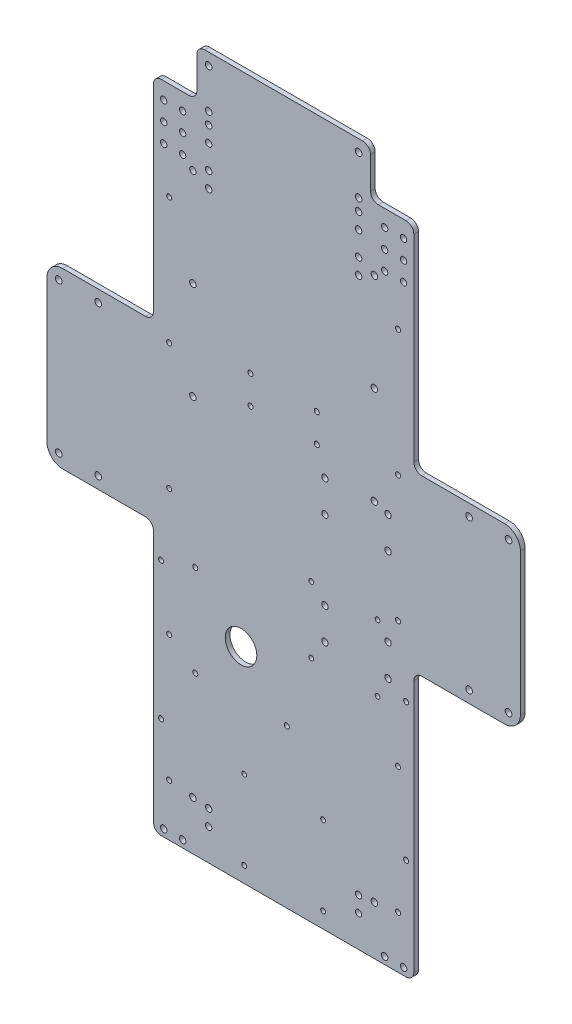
SolidWorks part; units mm, degrees
ref_plane "前视基准面" through (0, 0, 0) normal (0, 0, 1) x (1, 0, 0)
ref_plane "上视基准面" through (0, 0, 0) normal (0, 1, 0) x (1, 0, 0)
ref_plane "右视基准面" through (0, 0, 0) normal (1, 0, 0) x (0, 0, -1)
sketch "草图1" plane through (0, 0, 0) normal (0, 0, 1) x (1, 0, 0)
  line L0 (-50.9061, 33.4951) -> (-35.9061, 33.4951)
  line L1 (-50.9061, 103.4951) -> (79.0939, 103.4951)
  line L2 (-50.9061, 103.4951) -> (-50.9061, 33.4951)
  line L3 (-35.9061, -91.5049) -> (64.0939, -91.5049)
  line L4 (79.0939, 103.4951) -> (79.0939, 33.4951)
  line L5 (-35.9061, 33.4951) -> (-35.9061, -91.5049)
  line L6 (64.0939, -91.5049) -> (64.0939, 33.4951)
  line L7 (64.0939, 33.4951) -> (79.0939, 33.4951)
  dimension "D1" = 130
  dimension "D2" = 100
  dimension "D3" = 15
  dimension "D4" = 70
  dimension "D5" = 70
  dimension "D6" = 195
extrude "凸台-拉伸1" add sketch "草图1" along normal blind 3
sketch "草图2" plane through (0, 0, 3) normal (0, 0, 1) x (1, 0, 0)
  line L0 (79.0939, 103.4951) -> (-50.9061, 103.4951) construction
  line L1 (-40.9061, 103.4951) -> (69.0939, 103.4951)
  line L2 (-40.9061, 103.4951) -> (-40.9061, 123.4951)
  line L3 (-40.9061, 123.4951) -> (69.0939, 123.4951)
  line L4 (69.0939, 103.4951) -> (69.0939, 123.4951)
  line L5 (14.0939, -91.5049) -> (14.0939, 116.1376) construction
  line L6 (-35.9061, -91.5049) -> (64.0939, -91.5049) construction
  dimension "D1" = 55
  dimension "D2" = 55
  dimension "D3" = 20
extrude "凸台-拉伸2" add sketch "草图2" against normal up to surface (3 mm away)
sketch "草图3" plane through (0, 0, 3) normal (0, 0, 1) x (1, 0, 0)
  line L1 (-35.9061, 33.4951) -> (-95.9061, 33.4951)
  line L2 (-35.9061, 33.4951) -> (-35.9061, -116.5049)
  line L3 (-35.9061, -116.5049) -> (-95.9061, -116.5049)
  line L4 (-95.9061, 33.4951) -> (-95.9061, -116.5049)
  line L5 (64.0939, 33.4951) -> (124.0939, 33.4951)
  line L6 (64.0939, 33.4951) -> (64.0939, -116.5049)
  line L7 (64.0939, -116.5049) -> (124.0939, -116.5049)
  line L8 (124.0939, 33.4951) -> (124.0939, -116.5049)
  dimension "D1" = 60
  dimension "D2" = 150
  dimension "D3" = 150
  dimension "D4" = 60
extrude "凸台-拉伸3" add sketch "草图3" against normal up to surface (3 mm away)
sketch "草图4" plane through (0, 0, 3) normal (0, 0, 1) x (1, 0, 0)
  line L0 (-35.9061, -91.5049) -> (64.0939, -91.5049) construction
  line L1 (-35.9061, -91.5049) -> (64.0939, -91.5049)
  line L2 (-35.9061, -91.5049) -> (-35.9061, -261.5049)
  line L3 (-35.9061, -261.5049) -> (64.0939, -261.5049)
  line L4 (64.0939, -91.5049) -> (64.0939, -261.5049)
  dimension "D1" = 170
extrude "凸台-拉伸4" add sketch "草图4" against normal up to surface (3 mm away)
sketch "草图5" plane through (0, 0, 0) normal (0, 0, -1) x (-1, 0, 0)
  line L0 (-79.0939, 103.4951) -> (-69.0939, 103.4951) construction
  line L1 (-69.0939, 123.4951) -> (-69.0939, 103.4951) construction
  line L2 (-14.0939, 123.4951) -> (-14.0939, 75.6641) construction
  line L3 (40.9061, 123.4951) -> (-69.0939, 123.4951) construction
  circle A0 centre (-61.5939, 118.4951) radius 2.05
  circle A1 centre (-61.5939, 108.4951) radius 2.05
  circle A2 centre (33.4061, 108.4951) radius 2.05
  circle A3 centre (33.4061, 118.4951) radius 2.05
  dimension "D1" = 4.1
  dimension "D2" = 4.1
  dimension "D3" = 10
  dimension "D4" = 5
  dimension "D5" = 7.5
  dimension "D6" = 7.5
extrude "切除-拉伸1" cut sketch "草图5" against normal blind 10
sketch "草图6" plane through (0, 0, 0) normal (0, 0, -1) x (-1, 0, 0)
  line L0 (-14.0939, 123.4951) -> (-14.0939, -261.5049) construction
  line L1 (40.9061, 123.4951) -> (-69.0939, 123.4951) construction
  line L2 (-64.0939, -261.5049) -> (35.9061, -261.5049) construction
  line L4 (-39.0939, -201.5049) -> (10.9061, -201.5049) construction
  line L5 (-39.0939, -201.5049) -> (-39.0939, -251.5049) construction
  line L6 (-39.0939, -251.5049) -> (10.9061, -251.5049) construction
  line L7 (10.9061, -201.5049) -> (10.9061, -251.5049) construction
  circle A0 centre (10.9061, -201.5049) radius 1.5
  circle A1 centre (-39.0939, -201.5049) radius 1.5
  circle A2 centre (-39.0939, -251.5049) radius 1.5
  circle A3 centre (10.9061, -251.5049) radius 1.5
  dimension "D5" = 3
  dimension "D6" = 3
  dimension "D7" = 3
  dimension "D8" = 3
  dimension "D1" = 50
  dimension "D2" = 50
  dimension "D3" = 25
  dimension "D4" = 10
extrude "切除-拉伸2" cut sketch "草图6" against normal blind 10
sketch "草图7" plane through (0, 0, 0) normal (0, 0, -1) x (-1, 0, 0)
  line L0 (-64.0939, -116.5049) -> (-64.0939, -261.5049) construction
  line L1 (-124.0939, -116.5049) -> (-64.0939, -116.5049)
  line L2 (-124.0939, -116.5049) -> (-124.0939, -171.5049)
  line L3 (-124.0939, -171.5049) -> (-64.0939, -171.5049)
  line L4 (-64.0939, -116.5049) -> (-64.0939, -171.5049)
  line L5 (-14.0939, 123.4951) -> (-14.0939, -261.5049) construction
  line L6 (40.9061, 123.4951) -> (-69.0939, 123.4951) construction
  line L7 (-64.0939, -261.5049) -> (35.9061, -261.5049) construction
  line L8 (35.9061, -116.5049) -> (35.9061, -171.5049)
  line L9 (95.9061, -171.5049) -> (35.9061, -171.5049)
  line L10 (95.9061, -116.5049) -> (95.9061, -171.5049)
  line L11 (95.9061, -116.5049) -> (35.9061, -116.5049)
  dimension "D1" = 55
extrude "凸台-拉伸5" add sketch "草图7" against normal up to surface (3 mm away)
sketch "草图8" plane through (0, 0, 0) normal (0, 0, -1) x (-1, 0, 0)
  line L0 (-114.0939, -36.5049) -> (85.9061, -36.5049) construction
  line L1 (-124.0939, 33.4951) -> (-124.0939, -171.5049) construction
  line L3 (-14.0939, 123.4951) -> (-14.0939, -261.5049) construction
  line L4 (40.9061, 123.4951) -> (-69.0939, 123.4951) construction
  line L5 (-64.0939, -261.5049) -> (35.9061, -261.5049) construction
  circle A0 centre (-114.0939, 10.9951) radius 2
  circle A1 centre (-104.0939, 10.9951) radius 2
  circle A4 centre (-104.0939, -84.0049) radius 2
  circle A5 centre (-114.0939, -84.0049) radius 2
  circle A6 centre (85.9061, -84.0049) radius 2
  circle A7 centre (75.9061, -84.0049) radius 2
  circle A8 centre (75.9061, 10.9951) radius 2
  circle A9 centre (85.9061, 10.9951) radius 2
  dimension "D1" = 4
  dimension "D2" = 4
  dimension "D3" = 10
  dimension "D4" = 10
  dimension "D5" = 47.5
  dimension "D6" = 47.5
  dimension "D7" = 160
extrude "切除-拉伸3" cut sketch "草图8" against normal blind 10
sketch "草图9" plane through (0, 0, 0) normal (0, 0, -1) x (-1, 0, 0)
  line L0 (-14.0939, -261.5049) -> (-14.0939, -180.2572) construction
  line L1 (-64.0939, -261.5049) -> (35.9061, -261.5049) construction
  circle A0 centre (33.4061, -231.5049) radius 2
  circle A1 centre (33.4061, -241.5049) radius 2
  circle A2 centre (-61.5939, -241.5049) radius 2
  circle A3 centre (-61.5939, -231.5049) radius 2
  dimension "D1" = 4
  dimension "D2" = 4
  dimension "D3" = 10
  dimension "D4" = 20
  dimension "D5" = 47.5
  dimension "D6" = 47.5
extrude "切除-拉伸4" cut sketch "草图9" against normal blind 10
sketch "草图10" plane through (0, 0, 0) normal (0, 0, -1) x (-1, 0, 0)
  line L0 (-124.0939, -171.5049) -> (-64.0939, -171.5049) construction
  line L1 (-64.0939, -261.5049) -> (-69.0939, -261.5049)
  line L2 (-64.0939, -261.5049) -> (-64.0939, -171.5049)
  line L3 (-64.0939, -171.5049) -> (-69.0939, -171.5049)
  line L4 (-69.0939, -261.5049) -> (-69.0939, -171.5049)
  line L5 (-14.0939, -261.5049) -> (-14.0939, -148.6637) construction
  line L6 (-64.0939, -261.5049) -> (35.9061, -261.5049) construction
  line L7 (40.9061, -261.5049) -> (40.9061, -171.5049)
  line L8 (35.9061, -171.5049) -> (40.9061, -171.5049)
  line L9 (35.9061, -261.5049) -> (35.9061, -171.5049)
  line L10 (35.9061, -261.5049) -> (40.9061, -261.5049)
  circle A0 centre (-61.5939, -231.5049) radius 2 construction
  dimension "D1" = 7.5
extrude "凸台-拉伸6" add sketch "草图10" against normal up to surface (3 mm away)
sketch "草图11" plane through (0, 0, 0) normal (0, 0, -1) x (-1, 0, 0)
  line L1 (-69.0939, -261.5049) -> (40.9061, -261.5049)
  line L2 (-69.0939, -261.5049) -> (-69.0939, -266.5049)
  line L3 (-69.0939, -266.5049) -> (40.9061, -266.5049)
  line L4 (40.9061, -261.5049) -> (40.9061, -266.5049)
  dimension "D1" = 5
extrude "凸台-拉伸7" add sketch "草图11" against normal up to surface (3 mm away)
sketch "草图12" plane through (0, 0, 0) normal (0, 0, -1) x (-1, 0, 0)
  line L0 (-79.0939, 68.4951) -> (50.9061, 68.4951) construction
  line L1 (-79.0939, 33.4951) -> (-79.0939, 103.4951) construction
  line L2 (50.9061, 103.4951) -> (50.9061, 33.4951) construction
  line L3 (-14.0939, 123.4951) -> (-14.0939, -31.782) construction
  line L4 (40.9061, 123.4951) -> (-69.0939, 123.4951) construction
  line L5 (-14.0939, 68.4951) -> (-60.2666, -58.3634) construction
  line L6 (-14.0939, 68.4951) -> (10.2169, -69.3779) construction
  line L7 (-40.2666, -103.3634) -> (-80.2666, -103.3634) construction
  line L8 (-40.2666, -103.3634) -> (-40.2666, -13.3634) construction
  line L9 (-40.2666, -13.3634) -> (-80.2666, -13.3634) construction
  line L10 (-80.2666, -103.3634) -> (-80.2666, -13.3634) construction
  line L11 (-40.2666, -103.3634) -> (-80.2666, -13.3634) construction
  line L12 (-40.2666, -13.3634) -> (-80.2666, -103.3634) construction
  circle A0 centre (-14.0939, 68.4951) radius 97.5 construction
  circle A1 centre (-40.2666, -13.3634) radius 2
  circle A2 centre (-40.2666, -103.3634) radius 2
  circle A3 centre (-80.2666, -103.3634) radius 2
  circle A4 centre (-80.2666, -13.3634) radius 2
  circle A5 centre (-14.0939, 68.4951) radius 140 construction
  dimension "D1" = 195
  dimension "D3" = 90
  dimension "D4" = 135
  dimension "D5" = 40
  dimension "D6" = 4
  dimension "D7" = 4
  dimension "D8" = 4
  dimension "D9" = 4
  dimension "D2" = 20
  dimension "D10" = 140
  dimension "D12" = 10
extrude "切除-拉伸6" cut sketch "草图12" against normal blind 10
sketch "草图14" plane through (0, 0, 0) normal (0, 0, -1) x (-1, 0, 0)
  line L0 (-14.0939, 123.4951) -> (-14.0939, -266.5049) construction
  line L1 (-124.0939, 33.4951) -> (-100.0939, 33.4951)
  line L2 (-124.0939, 33.4951) -> (-124.0939, 18.4951)
  line L3 (-124.0939, 18.4951) -> (-100.0939, 18.4951)
  line L4 (-100.0939, 33.4951) -> (-100.0939, 18.4951)
  line L5 (-124.0939, -171.5049) -> (-100.0939, -171.5049)
  line L6 (-124.0939, -171.5049) -> (-124.0939, -91.5049)
  line L7 (-124.0939, -91.5049) -> (-100.0939, -91.5049)
  line L8 (-100.0939, -171.5049) -> (-100.0939, -91.5049)
  line L9 (40.9061, 123.4951) -> (-69.0939, 123.4951) construction
  line L10 (-69.0939, -266.5049) -> (40.9061, -266.5049) construction
  line L11 (71.9061, -171.5049) -> (71.9061, -91.5049)
  line L12 (95.9061, -91.5049) -> (71.9061, -91.5049)
  line L13 (95.9061, -171.5049) -> (95.9061, -91.5049)
  line L14 (95.9061, -171.5049) -> (71.9061, -171.5049)
  line L15 (71.9061, 33.4951) -> (71.9061, 18.4951)
  line L16 (95.9061, 18.4951) -> (71.9061, 18.4951)
  line L17 (95.9061, 33.4951) -> (95.9061, 18.4951)
  line L18 (95.9061, 33.4951) -> (71.9061, 33.4951)
  dimension "D1" = 24
  dimension "D2" = 24
  dimension "D3" = 15
  dimension "D4" = 80
extrude "切除-拉伸7" cut sketch "草图14" against normal blind 8
sketch "草图15" plane through (0, 0, 0) normal (0, 0, -1) x (-1, 0, 0)
  circle A0 centre (-80.2666, -33.3634) radius 2
  circle A1 centre (-40.2666, -33.3634) radius 2
  circle A2 centre (-80.2666, -83.3634) radius 2
  circle A3 centre (-40.2666, -83.3634) radius 2
  circle A4 centre (-80.2666, -13.3634) radius 2 construction
  circle A5 centre (-40.2666, -13.3634) radius 2 construction
  circle A6 centre (-40.2666, -103.3634) radius 2 construction
  circle A7 centre (-80.2666, -103.3634) radius 2 construction
  dimension "D1" = 4
  dimension "D2" = 4
  dimension "D3" = 4
  dimension "D4" = 4
  dimension "D5" = 20
  dimension "D6" = 20
  dimension "D7" = 20
  dimension "D8" = 20
extrude "切除-拉伸8" cut sketch "草图15" against normal blind 8
sketch "草图16" plane through (0, 0, 0) normal (0, 0, -1) x (-1, 0, 0)
  line L1 (40.9061, 103.4951) -> (40.9061, 123.4951) construction
  line L2 (-69.0939, 123.4951) -> (40.9061, 123.4951)
  line L3 (-69.0939, 123.4951) -> (-69.0939, 153.4951)
  line L4 (-69.0939, 153.4951) -> (40.9061, 153.4951)
  line L5 (40.9061, 123.4951) -> (40.9061, 153.4951)
  dimension "D1" = 30
extrude "凸台-拉伸8" add sketch "草图16" against normal up to surface (3 mm away)
sketch "草图18" plane through (0, 0, 0) normal (0, 0, -1) x (-1, 0, 0)
  line L0 (40.9061, -266.5049) -> (40.9061, -171.5049) construction
  line L1 (-69.0939, -266.5049) -> (40.9061, -266.5049)
  line L2 (-69.0939, -266.5049) -> (-69.0939, -261.5049)
  line L3 (-69.0939, -261.5049) -> (40.9061, -261.5049)
  line L4 (40.9061, -266.5049) -> (40.9061, -261.5049)
  dimension "D1" = 5
extrude "切除-拉伸11" cut sketch "草图18" against normal blind 10
sketch "草图19" plane through (0, 0, 0) normal (0, 0, -1) x (-1, 0, 0)
  line L1 (-100.0939, 33.4951) -> (-96.5939, 33.4951)
  line L2 (-100.0939, 33.4951) -> (-100.0939, 18.4951)
  line L3 (-100.0939, 18.4951) -> (-96.5939, 18.4951)
  line L4 (-96.5939, 33.4951) -> (-96.5939, 18.4951)
  line L5 (71.9061, 33.4951) -> (68.4061, 33.4951)
  line L6 (71.9061, 33.4951) -> (71.9061, 18.4951)
  line L7 (71.9061, 18.4951) -> (68.4061, 18.4951)
  line L8 (68.4061, 33.4951) -> (68.4061, 18.4951)
  line L9 (71.9061, -171.5049) -> (68.4061, -171.5049)
  line L10 (71.9061, -171.5049) -> (71.9061, -91.5049)
  line L11 (71.9061, -91.5049) -> (68.4061, -91.5049)
  line L12 (68.4061, -171.5049) -> (68.4061, -91.5049)
  line L13 (-100.0939, -171.5049) -> (-96.5939, -171.5049)
  line L14 (-100.0939, -171.5049) -> (-100.0939, -91.5049)
  line L15 (-100.0939, -91.5049) -> (-96.5939, -91.5049)
  line L16 (-96.5939, -171.5049) -> (-96.5939, -91.5049)
  dimension "D1" = 3.5
  dimension "D2" = 3.5
  dimension "D3" = 3.5
  dimension "D4" = 3.5
extrude "切除-拉伸12" cut sketch "草图19" against normal blind 10
sketch "草图20" plane through (0, 0, 0) normal (0, 0, -1) x (-1, 0, 0)
  line L1 (-96.5939, 33.4951) -> (-69.0939, 33.4951)
  line L2 (-96.5939, 33.4951) -> (-96.5939, 153.4951)
  line L3 (-96.5939, 153.4951) -> (-69.0939, 153.4951)
  line L4 (-69.0939, 33.4951) -> (-69.0939, 153.4951)
  line L5 (68.4061, 33.4951) -> (40.9061, 33.4951)
  line L6 (68.4061, 33.4951) -> (68.4061, 153.4951)
  line L7 (68.4061, 153.4951) -> (40.9061, 153.4951)
  line L8 (40.9061, 33.4951) -> (40.9061, 153.4951)
  line L9 (-96.5939, -171.5049) -> (-69.0939, -171.5049)
  line L10 (-96.5939, -171.5049) -> (-96.5939, -261.5049)
  line L11 (-96.5939, -261.5049) -> (-69.0939, -261.5049)
  line L12 (-69.0939, -171.5049) -> (-69.0939, -261.5049)
  line L13 (68.4061, -171.5049) -> (40.9061, -171.5049)
  line L14 (68.4061, -171.5049) -> (68.4061, -261.5049)
  line L15 (68.4061, -261.5049) -> (40.9061, -261.5049)
  line L16 (40.9061, -171.5049) -> (40.9061, -261.5049)
extrude "凸台-拉伸9" add sketch "草图20" against normal up to surface (3 mm away)
sketch "草图21" plane through (0, 0, 0) normal (0, 0, -1) x (-1, 0, 0)
  line L0 (68.4061, 153.4951) -> (68.4061, 18.4951) construction
  line L1 (68.4061, 153.4951) -> (-96.5939, 153.4951) construction
  line L2 (-14.0939, 153.4951) -> (-14.0939, 74.4578) construction
  line L3 (-14.0939, 165.4951) -> (-14.0939, 86.4578) construction
  circle A0 centre (61.9061, 130.9951) radius 2
  circle A1 centre (49.9061, 130.9951) radius 2
  circle A2 centre (-78.0939, 130.9951) radius 2
  circle A3 centre (-90.0939, 130.9951) radius 2
  circle A4 centre (61.9061, 142.9951) radius 2
  circle A5 centre (49.9061, 142.9951) radius 2
  circle A6 centre (-78.0939, 142.9951) radius 2
  circle A7 centre (-90.0939, 142.9951) radius 2
  dimension "D1" = 6.5
  dimension "D2" = 12
  dimension "D3" = 4
  dimension "D4" = 4
  dimension "D5" = 22.5
  dimension "D6" = 2
extrude "切除-拉伸13" cut sketch "草图21" against normal blind 10
sketch "草图22" plane through (0, 0, 0) normal (0, 0, -1) x (-1, 0, 0)
  line L0 (-96.5939, -261.5049) -> (-96.5939, -91.5049) construction
  line L1 (68.4061, -261.5049) -> (-96.5939, -261.5049) construction
  line L2 (-14.0939, -261.5049) -> (-14.0939, -180.4875) construction
  circle A0 centre (-90.0939, -257.0049) radius 2.05
  circle A1 centre (-78.0939, -257.0049) radius 2.05
  circle A2 centre (49.9061, -257.0049) radius 2.05
  circle A3 centre (61.9061, -257.0049) radius 2.05
  dimension "D1" = 4.1
  dimension "D2" = 4.1
  dimension "D3" = 12
  dimension "D4" = 6.5
  dimension "D5" = 4.5
extrude "切除-拉伸14" cut sketch "草图22" against normal blind 10
sketch "草图26" plane through (0, 0, 0) normal (0, 0, -1) x (-1, 0, 0)
  line L0 (-14.0939, 153.4951) -> (-14.0939, -261.5049) construction
  line L1 (68.4061, 153.4951) -> (-96.5939, 153.4951) construction
  line L2 (-96.5939, -261.5049) -> (68.4061, -261.5049) construction
  line L3 (68.4061, 153.4951) -> (-96.5939, 153.4951) construction
  circle A0 centre (43.4061, 113.4951) radius 2.06
  circle A1 centre (-71.5939, 113.4951) radius 2.06
  circle A2 centre (43.4061, 51.4951) radius 2.06
  circle A3 centre (-71.5939, 51.4951) radius 2.06
  circle A4 centre (43.4061, -10.5049) radius 2.06
  circle A5 centre (-71.5939, -10.5049) radius 2.06
  circle A6 centre (43.4061, -230.5049) radius 2.06
  circle A7 centre (-71.5939, -230.5049) radius 2.06
  dimension "D1" = 4.12
  dimension "D2" = 115
  dimension "D3" = 40
  dimension "D4" = 3
  dimension "D5" = 2
extrude "切除-拉伸22" cut sketch "草图26" against normal up to surface (3 mm away)
sketch "草图27" plane through (0, 0, 0) normal (0, 0, -1) x (-1, 0, 0)
  circle A0 centre (33.4061, 108.4951) radius 2.05 construction
  circle A1 centre (33.4061, 118.4951) radius 2.05 construction
  circle A2 centre (-61.5939, 108.4951) radius 2.05 construction
  circle A3 centre (-61.5939, 118.4951) radius 2.05 construction
  circle A4 centre (33.4061, 108.4951) radius 2.05
  circle A5 centre (33.4061, 118.4951) radius 2.05
  circle A6 centre (-61.5939, 108.4951) radius 2.05
  circle A7 centre (-61.5939, 118.4951) radius 2.05
  circle A8 centre (33.4061, 133.4951) radius 2.05
  circle A9 centre (33.4061, 143.4951) radius 2.05
  circle A10 centre (-61.5939, 133.4951) radius 2.05
  circle A11 centre (-61.5939, 143.4951) radius 2.05
  dimension "D1" = 2
extrude "切除-拉伸23" cut sketch "草图27" against normal blind 125
sketch "草图29" plane through (0, 0, 0) normal (0, 0, -1) x (-1, 0, 0)
  circle A0 centre (61.9061, 130.9951) radius 2 construction
  circle A1 centre (49.9061, 130.9951) radius 2 construction
  circle A2 centre (-78.0939, 130.9951) radius 2 construction
  circle A3 centre (-90.0939, 130.9951) radius 2 construction
  circle A4 centre (61.9061, 130.9951) radius 2
  circle A5 centre (49.9061, 130.9951) radius 2
  circle A6 centre (-78.0939, 130.9951) radius 2
  circle A7 centre (-90.0939, 130.9951) radius 2
  circle A8 centre (61.9061, 118.9951) radius 2
  circle A9 centre (49.9061, 118.9951) radius 2
  circle A10 centre (-78.0939, 118.9951) radius 2
  circle A11 centre (-90.0939, 118.9951) radius 2
  dimension "D1" = 2
extrude "切除-拉伸25" cut sketch "草图29" against normal blind 10
fillet "圆角1" radius 5 12 edges at (96.5939, 18.4951, 1.5) (124.0939, 18.4951, 1.5) (124.0939, -91.5049, 1.5) (96.5939, -91.5049, 1.5) (96.5939, -261.5049, 1.5) (-68.4061, -261.5049, 1.5) (-68.4061, -91.5049, 1.5) (-95.9061, -91.5049, 1.5) (-95.9061, 18.4951, 1.5) (-68.4061, 18.4951, 1.5) (-68.4061, 153.4951, 1.5) (96.5939, 153.4951, 1.5)
sketch "草图30" plane through (0, 0, 0) normal (0, 0, -1) x (-1, 0, 0)
  line L0 (-14.0939, 153.4951) -> (-14.0939, -261.5049) construction
  line L1 (63.4061, 153.4951) -> (-91.5939, 153.4951) construction
  line L2 (63.4061, -261.5049) -> (-91.5939, -261.5049) construction
  circle A0 centre (58.4061, -228.5049) radius 1.6 construction
  circle A1 centre (58.4061, -148.5049) radius 1.6 construction
  circle A2 centre (58.4061, -68.5049) radius 1.6 construction
  circle A3 centre (58.4061, 11.4951) radius 1.6 construction
  circle A4 centre (58.4061, 91.4951) radius 1.6 construction
  circle A5 centre (58.4061, -228.5049) radius 1.6
  circle A6 centre (58.4061, -148.5049) radius 1.6
  circle A7 centre (58.4061, -68.5049) radius 1.6
  circle A8 centre (58.4061, 11.4951) radius 1.6
  circle A9 centre (58.4061, 91.4951) radius 1.6
  circle A10 centre (-86.5939, 91.4951) radius 1.6
  circle A11 centre (-86.5939, 11.4951) radius 1.6
  circle A12 centre (-86.5939, -68.5049) radius 1.6
  circle A13 centre (-86.5939, -148.5049) radius 1.6
  circle A14 centre (-86.5939, -228.5049) radius 1.6
extrude "切除-拉伸27" cut sketch "草图30" against normal blind 55
sketch "草图31" plane through (0, 0, 0) normal (0, 0, -1) x (-1, 0, 0)
  circle A0 centre (-114.0939, -84.0049) radius 2
  circle A1 centre (-104.0939, -84.0049) radius 2
  circle A2 centre (-114.0939, 10.9951) radius 2
  circle A3 centre (-104.0939, 10.9951) radius 2
  circle A4 centre (75.9061, -84.0049) radius 2
  circle A5 centre (85.9061, -84.0049) radius 2
  circle A6 centre (75.9061, 10.9951) radius 2
  circle A7 centre (85.9061, 10.9951) radius 2
  circle A8 centre (-104.0939, -84.0049) radius 2 construction
extrude "凸台-拉伸10" add sketch "草图31" against normal up to surface (3 mm away)
sketch "草图32" plane through (0, 0, 0) normal (0, 0, -1) x (-1, 0, 0)
  line L0 (-119.0939, -91.5049) -> (-164.0939, -91.5049)
  line L1 (-164.0939, -91.5049) -> (-164.0939, 18.4951)
  line L2 (-164.0939, 18.4951) -> (-119.0939, 18.4951)
  line L3 (-14.0939, 153.4951) -> (-14.0939, -373.0384) construction
  line L4 (135.9061, 18.4951) -> (90.9061, 18.4951)
  line L5 (135.9061, -91.5049) -> (135.9061, 18.4951)
  line L6 (90.9061, -91.5049) -> (135.9061, -91.5049)
  line L12 (-101.5939, 18.4951) -> (-119.0939, 18.4951)
  line L13 (-124.0939, 13.4951) -> (-124.0939, -86.5049)
  line L14 (-119.0939, -91.5049) -> (-101.5939, -91.5049)
  line L15 (-96.5939, -96.5049) -> (-96.5939, -256.5049)
  line L16 (-91.5939, -261.5049) -> (63.4061, -261.5049)
  line L17 (68.4061, -256.5049) -> (68.4061, -96.5049)
  line L18 (73.4061, -91.5049) -> (90.9061, -91.5049)
  line L19 (95.9061, -86.5049) -> (95.9061, 13.4951)
  line L20 (90.9061, 18.4951) -> (73.4061, 18.4951)
  line L21 (68.4061, 23.4951) -> (68.4061, 148.4951)
  line L22 (63.4061, 153.4951) -> (-91.5939, 153.4951)
  line L23 (-96.5939, 148.4951) -> (-96.5939, 23.4951)
  line L24 (-101.5939, 18.4951) -> (-119.0939, 18.4951)
  line L25 (-124.0939, 13.4951) -> (-124.0939, -86.5049)
  line L26 (-119.0939, -91.5049) -> (-101.5939, -91.5049)
  line L27 (-96.5939, -96.5049) -> (-96.5939, -256.5049)
  line L28 (-91.5939, -261.5049) -> (63.4061, -261.5049)
  line L29 (68.4061, -256.5049) -> (68.4061, -96.5049)
  line L30 (73.4061, -91.5049) -> (90.9061, -91.5049)
  line L31 (95.9061, -86.5049) -> (95.9061, 13.4951)
  line L32 (90.9061, 18.4951) -> (73.4061, 18.4951)
  line L33 (68.4061, 23.4951) -> (68.4061, 148.4951)
  line L34 (63.4061, 153.4951) -> (-91.5939, 153.4951)
  line L35 (-96.5939, 148.4951) -> (-96.5939, 23.4951)
  arc A12 (-119.0939, 18.4951) -> (-124.0939, 13.4951) centre (-119.0939, 13.4951) ccw
  arc A13 (-124.0939, -86.5049) -> (-119.0939, -91.5049) centre (-119.0939, -86.5049) ccw
  arc A14 (-96.5939, -96.5049) -> (-101.5939, -91.5049) centre (-101.5939, -96.5049) ccw
  arc A15 (-96.5939, -256.5049) -> (-91.5939, -261.5049) centre (-91.5939, -256.5049) ccw
  arc A16 (63.4061, -261.5049) -> (68.4061, -256.5049) centre (63.4061, -256.5049) ccw
  arc A17 (73.4061, -91.5049) -> (68.4061, -96.5049) centre (73.4061, -96.5049) ccw
  arc A18 (90.9061, -91.5049) -> (95.9061, -86.5049) centre (90.9061, -86.5049) ccw
  arc A19 (95.9061, 13.4951) -> (90.9061, 18.4951) centre (90.9061, 13.4951) ccw
  arc A20 (68.4061, 23.4951) -> (73.4061, 18.4951) centre (73.4061, 23.4951) ccw
  arc A21 (68.4061, 148.4951) -> (63.4061, 153.4951) centre (63.4061, 148.4951) ccw
  arc A22 (-91.5939, 153.4951) -> (-96.5939, 148.4951) centre (-91.5939, 148.4951) ccw
  arc A23 (-101.5939, 18.4951) -> (-96.5939, 23.4951) centre (-101.5939, 23.4951) ccw
  arc A24 (-119.0939, 18.4951) -> (-124.0939, 13.4951) centre (-119.0939, 13.4951) ccw
  arc A25 (-124.0939, -86.5049) -> (-119.0939, -91.5049) centre (-119.0939, -86.5049) ccw
  arc A26 (-96.5939, -96.5049) -> (-101.5939, -91.5049) centre (-101.5939, -96.5049) ccw
  arc A27 (-96.5939, -256.5049) -> (-91.5939, -261.5049) centre (-91.5939, -256.5049) ccw
  arc A28 (63.4061, -261.5049) -> (68.4061, -256.5049) centre (63.4061, -256.5049) ccw
  arc A29 (73.4061, -91.5049) -> (68.4061, -96.5049) centre (73.4061, -96.5049) ccw
  arc A30 (90.9061, -91.5049) -> (95.9061, -86.5049) centre (90.9061, -86.5049) ccw
  arc A31 (95.9061, 13.4951) -> (90.9061, 18.4951) centre (90.9061, 13.4951) ccw
  arc A32 (68.4061, 23.4951) -> (73.4061, 18.4951) centre (73.4061, 23.4951) ccw
  arc A33 (68.4061, 148.4951) -> (63.4061, 153.4951) centre (63.4061, 148.4951) ccw
  arc A34 (-91.5939, 153.4951) -> (-96.5939, 148.4951) centre (-91.5939, 148.4951) ccw
  arc A35 (-101.5939, 18.4951) -> (-96.5939, 23.4951) centre (-101.5939, 23.4951) ccw
  dimension "D2" = 40
  dimension "D1" = 0
extrude "凸台-拉伸11" add sketch "草图32" against normal up to surface (3 mm away) contours A31 L31 A30 L6 L5 L4 | A25 L25 A24 L2 L1 L0
fillet "圆角2" radius 10 4 edges at (-135.9061, 18.4951, 1.5) (-135.9061, -91.5049, 1.5) (164.0939, 18.4951, 1.5) (164.0939, -91.5049, 1.5)
sketch "草图33" plane through (0, 0, 0) normal (0, 0, -1) x (-1, 0, 0)
  line L0 (-14.0939, 153.4951) -> (-14.0939, -282.9403) construction
  line L1 (63.4061, 153.4951) -> (-91.5939, 153.4951) construction
  line L2 (-164.0939, -36.5049) -> (171.8334, -36.5049) construction
  line L3 (-164.0939, -81.5049) -> (-164.0939, 8.4951) construction
  circle A0 centre (-156.5939, -84.0049) radius 2.1
  circle A1 centre (-131.5939, -84.0049) radius 2.1
  circle A2 centre (-131.5939, 10.9951) radius 2.1
  circle A3 centre (-156.5939, 10.9951) radius 2.1
  circle A4 centre (128.4061, 10.9951) radius 2.1
  circle A5 centre (103.4061, 10.9951) radius 2.1
  circle A6 centre (103.4061, -84.0049) radius 2.1
  circle A7 centre (128.4061, -84.0049) radius 2.1
  dimension "D1" = 25
  dimension "D2" = 95
  dimension "D3" = 4.2
  dimension "D4" = 7.5
extrude "切除-拉伸28" cut sketch "草图33" against normal blind 10
sketch "草图34" plane through (0, 0, 0) normal (0, 0, -1) x (-1, 0, 0)
  line L0 (-14.0939, 153.4951) -> (-14.0939, 266.7057) construction
  line L1 (63.4061, 153.4951) -> (-91.5939, 153.4951) construction
  line L3 (40.9061, 183.4951) -> (-69.0939, 183.4951)
  line L4 (40.9061, 183.4951) -> (40.9061, 153.4951)
  line L5 (40.9061, 153.4951) -> (-69.0939, 153.4951)
  line L6 (-69.0939, 183.4951) -> (-69.0939, 153.4951)
  line L7 (40.9061, 183.4951) -> (-69.0939, 153.4951) construction
  line L8 (40.9061, 153.4951) -> (-69.0939, 183.4951) construction
  point P4 (-14.0939, 168.4951)
  dimension "D1" = 110
  dimension "D2" = 30
extrude "凸台-拉伸12" add sketch "草图34" against normal up to surface (3 mm away)
fillet "圆角3" radius 5 4 edges at (-40.9061, 153.4951, 1.5) (-40.9061, 183.4951, 1.5) (69.0939, 183.4951, 1.5) (69.0939, 153.4951, 1.5)
sketch "草图35" plane through (0, 0, 0) normal (0, 0, -1) x (-1, 0, 0)
  line L0 (-14.0939, 183.4951) -> (-14.0939, 77.6361) construction
  line L1 (35.9061, 183.4951) -> (-64.0939, 183.4951) construction
  circle A0 centre (33.4061, 150.9951) radius 2.1
  circle A1 centre (33.4061, 175.9951) radius 2.1
  circle A2 centre (-61.5939, 175.9951) radius 2.1
  circle A3 centre (-61.5939, 150.9951) radius 2.1
  dimension "D1" = 95
  dimension "D2" = 7.5
  dimension "D3" = 25
  dimension "D4" = 4.2
extrude "切除-拉伸29" cut sketch "草图35" against normal blind 10
sketch "草图37" plane through (0, 0, 3) normal (0, 0, 1) x (1, 0, 0)
  circle A0 centre (-41.9061, -103.5049) radius 1.6
  circle A1 centre (-41.9061, -161.5049) radius 1.6
  circle A2 centre (16.0939, -161.5049) radius 1.6
  circle A3 centre (-12.9061, -132.5049) radius 10
extrude "切除-拉伸30" cut sketch "草图37" against normal blind 10
sketch "草图38" plane through (0, 0, 3) normal (0, 0, 1) x (1, 0, 0)
  line L0 (96.5939, -96.5049) -> (96.5939, -256.5049) construction
  line L1 (91.5939, -261.5049) -> (-63.4061, -261.5049) construction
  circle A0 centre (31.5939, -116.5049) radius 1.5
  circle A1 centre (73.5939, -116.5049) radius 1.5
  circle A2 centre (73.5939, -74.5049) radius 1.5
  circle A3 centre (31.5939, -74.5049) radius 1.5
  dimension "D1" = 3
  dimension "D2" = 65
  dimension "D3" = 145
  dimension "D4" = 2
  dimension "D5" = 2
extrude "切除-拉伸31" cut sketch "草图38" against normal blind 10
sketch "草图39" plane through (0, 0, 0) normal (0, 0, -1) x (-1, 0, 0)
  circle A0 centre (-91.7309, -110.4049) radius 1.6
  circle A1 centre (-91.7309, -197.4049) radius 1.6
  circle A2 centre (63.5432, -197.4049) radius 1.6
  circle A3 centre (63.5432, -110.4049) radius 1.6
extrude "切除-拉伸32" cut sketch "草图39" against normal blind 40
sketch "草图40" plane through (0, 0, 0) normal (0, 0, -1) x (-1, 0, 0)
  circle A0 centre (-35.0939, 20.4951) radius 1.6
  circle A1 centre (6.9061, 20.4951) radius 1.6
  circle A2 centre (6.9061, 2.4951) radius 1.6
  circle A3 centre (-35.0939, 2.4951) radius 1.6
extrude "切除-拉伸33" cut sketch "草图40" against normal blind 10
